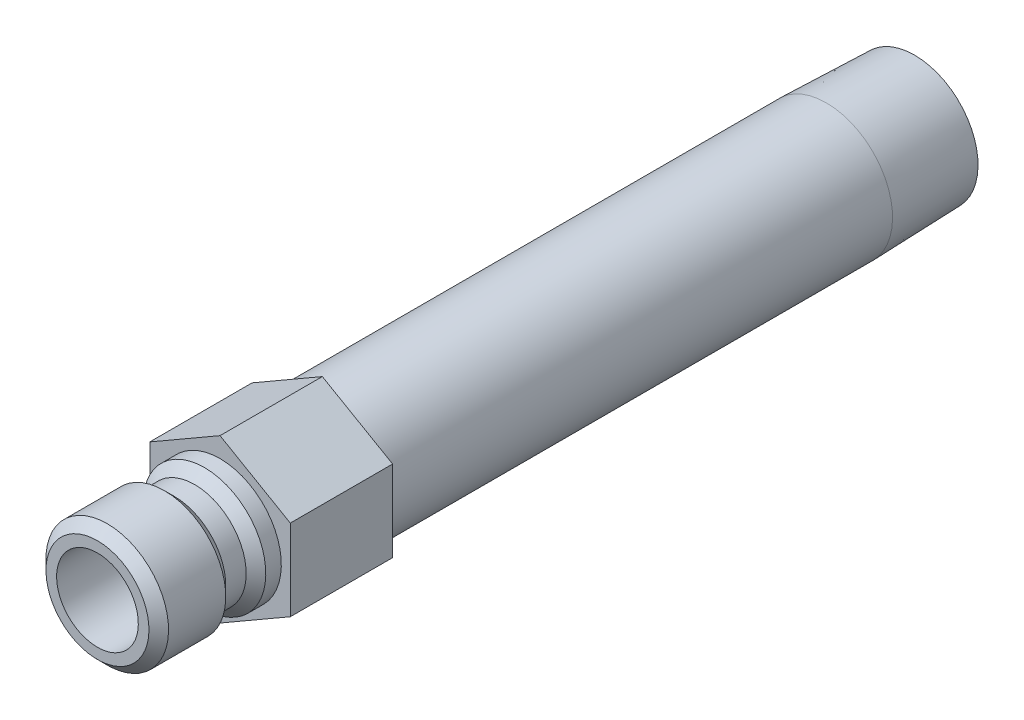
SolidWorks part; units mm, degrees
ref_plane "Front Plane" through (0, 0, 0) normal (0, 0, 1) x (1, 0, 0)
ref_plane "Top Plane" through (0, 0, 0) normal (0, 1, 0) x (1, 0, 0)
ref_plane "Right Plane" through (0, 0, 0) normal (1, 0, 0) x (0, 0, -1)
sketch "Sketch1" plane through (0, 0, 0) normal (1, 0, 0) x (0, 0, -1)
  line L0 (0, 0) -> (-12.7, 0) construction
  line L1 (-9.525, 3.175) -> (-9.525, 4.0005)
  line L2 (-3.556, 4.0005) -> (-3.556, 0) construction
  line L3 (-8.763, 4.7625) -> (-4.318, 4.7625)
  line L4 (0, 5.1435) -> (0, 3.4163) construction
  line L5 (-3.556, 4.0005) -> (-1.9685, 4.0005)
  line L6 (-1.2065, 4.7625) -> (0, 4.7625)
  line L7 (0, 4.7625) -> (0, 5.1435)
  line L8 (-3.556, 4.0005) -> (-4.318, 4.7625)
  line L9 (-1.9685, 4.0005) -> (-1.2065, 4.7625)
  line L10 (-9.525, 4.0005) -> (-8.763, 4.7625)
  line L12 (0, 5.1435) -> (47.117, 5.1435)
  line L13 (47.117, 5.1435) -> (53.975, 4.9292)
  line L14 (53.975, 4.9292) -> (53.975, 2.3813)
  line L15 (0, 0) -> (7.9502, 0) construction
  line L16 (7.9502, 0) -> (7.9502, 4.7625) construction
  line L17 (7.9502, 4.7625) -> (0, 4.7625) construction
  line L18 (0.127, 2.3813) -> (53.975, 2.3813)
  line L19 (0.127, 3.175) -> (-9.525, 3.175)
  line L20 (0, 3.175) -> (0, 0) construction
  line L21 (0.127, 2.3813) -> (0.127, 3.175)
  dimension "D1" = 9.525
  dimension "D2" = 1.5875
  dimension "D3" = 0.762
  dimension "D4" = 45
  dimension "D5" = 5.969
  dimension "D6" = 45
  dimension "D7" = 1.79
  dimension "D8" = 6.858
  dimension "D9" = 63.5
  dimension "D10" = 3.175
  dimension "D11" = 17.4752
  dimension "D12" = 4.7625
  dimension "D13" = 6.35
  dimension "D14" = 9.525
  dimension "D15" = 10.287
  dimension "D16" = 9.652
revolve "Revolve1" add sketch "Sketch1" angle 360 about L0
sketch "Sketch2" plane through (0, 0, 0) normal (0, 0, 1) x (1, 0, 0)
  line L1 (-5.461, 3.1529) -> (-5.461, -3.1529)
  line L2 (-5.461, -3.1529) -> (0, -6.3058)
  line L3 (0, -6.3058) -> (5.461, -3.1529)
  line L4 (5.461, -3.1529) -> (5.461, 3.1529)
  line L5 (5.461, 3.1529) -> (0, 6.3058)
  line L6 (0, 6.3058) -> (-5.461, 3.1529)
  circle A0 centre (0, 0) radius 5.461 construction
  circle A1 centre (0, 0) radius 2.3812 construction
  circle A2 centre (0, 0) radius 2.3812
  dimension "D1" = 10.922
extrude "Boss-Extrude1" add sketch "Sketch2" against normal up to vertex (7.9502 mm away) from vertex at 0
